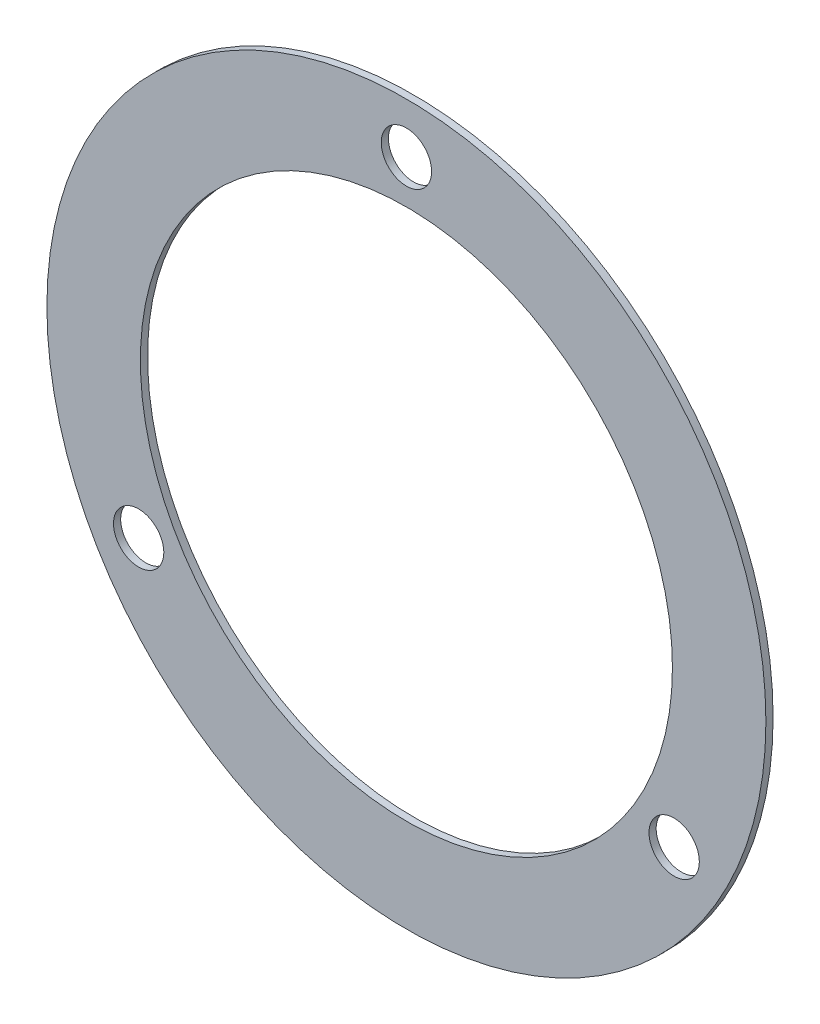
SolidWorks part; units mm, degrees
ref_plane "Plan1" through (0, 0, 0) normal (0, 0, 1) x (1, 0, 0)
ref_plane "Plan2" through (0, 0, 0) normal (0, 1, 0) x (1, 0, 0)
ref_plane "Plan3" through (0, 0, 0) normal (1, 0, 0) x (0, 0, -1)
sketch "Esquisse1" plane through (0, 0, 0) normal (0, 0, 1) x (1, 0, 0)
  line L0 (-73.4847, 42.4264) -> (61.2372, -35.3553) construction
  line L1 (0, 80) -> (0, -90) construction
  line L2 (-70, 0) -> (80, 0) construction
  line L3 (-69.6557, -40.2158) -> (69.6557, 40.2158) construction
  circle A0 centre (0, 0) radius 50
  circle A1 centre (0, 0) radius 37
  circle A3 centre (-37.2391, -21.5) radius 3.5
  circle A4 centre (37.2391, -21.5) radius 3.5
  circle A5 centre (0, 43) radius 3.5
  dimension "D1" = 100
  dimension "D2" = 74
  dimension "D6" = 7
  dimension "D7" = 7
  dimension "D8" = 7
  dimension "D3" = 60
  dimension "D4" = 60
extrude "Base-Extrusion" add sketch "Esquisse1" along normal blind 1
